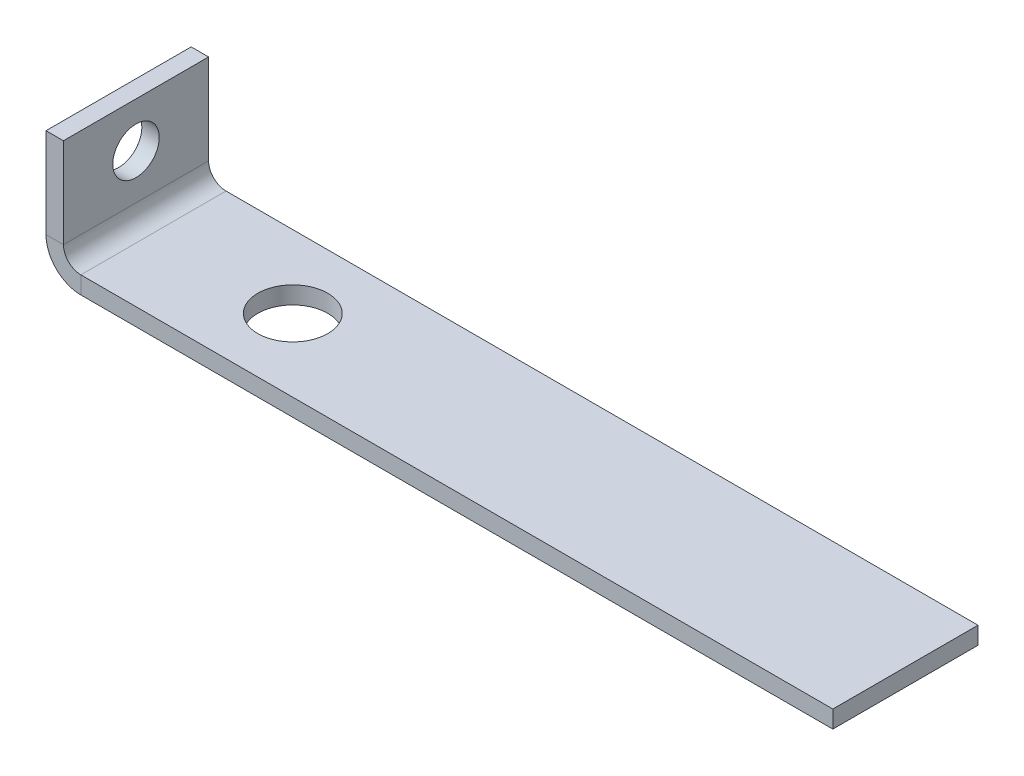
SolidWorks part; units mm, degrees
ref_plane "Plan1" through (0, 0, 0) normal (0, 0, 1) x (1, 0, 0)
ref_plane "Plan2" through (0, 0, 0) normal (0, 1, 0) x (1, 0, 0)
ref_plane "Plan3" through (0, 0, 0) normal (1, 0, 0) x (0, 0, -1)
sketch "Esquisse1" plane through (0, 0, 0) normal (0, 0, 1) x (1, 0, 0)
  line L1 (-9.7, -0.15) -> (-9.7, 1.85)
  line L2 (3.7, -0.15) -> (-9.7, -0.15)
  line L3 (3.7, -0.15) -> (-9.7, -0.15)
  line L4 (-9.7, -0.3) -> (-9.7, 0) construction
  dimension "D2" = 2
  dimension "D1" = 0.15
extrude "lame" add sketch "Esquisse1" along normal mid plane 2.5 thin
sketch "Esquisse2" plane through (0, 0, 0) normal (0, 1, 0) x (-1, 0, 0)
  line L0 (-3.7, 1.25) -> (9.55, 1.25) construction
  line L1 (9.55, 1.25) -> (9.55, -1.25) construction
  circle A0 centre (6.85, 0) radius 0.6024
  dimension "D1" = 1.2048
  dimension "D3" = 2.7
  dimension "D2" = 1.25
extrude "Enlèv. mat.-Extru.1" cut sketch "Esquisse2" against normal through all
sheet metal parameters "Tôlerie 1" parameters "D1"=0.3
bend "Pli dans angle1" parameters "D1"=0
flatten bends "Dépliage 1" parameters "D1"=0, "D4"=90, "D5"=1
sketch "Esquisse-Angle1" plane through (0, 0, 0) normal (0, 1, 0) x (-1, 0, 0)
  line L0 (9.6034, -1.25) -> (9.6034, 1.25) construction
sketch "Esquisse5" plane through (0, 0, 0) normal (0, 1, 0) x (0, 0, -1)
  line L1 (-1.25, 11.5069) -> (-1.25, 9.9569) construction
  circle A0 centre (0, 10.7319) radius 0.4
  point P2 (-1.25, 10.7319)
  dimension "D1" = 0.8
extrude "fixation patte led" cut sketch "Esquisse5" against normal through all
process bends "Pliage 1" parameters "D1"=0
sketch "Esquisse-Plate1" plane through (0, 0, 0) normal (0, 1, 0) x (-1, 0, 0)
